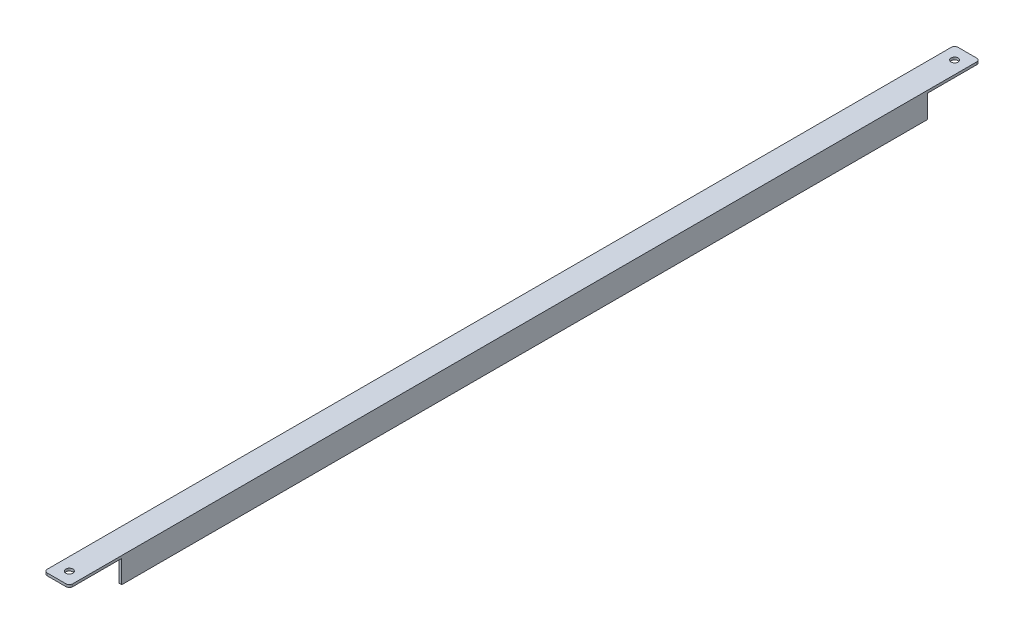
SolidWorks part; units mm, degrees
ref_plane "Front Plane" through (0, 0, 0) normal (0, 0, 1) x (1, 0, 0)
ref_plane "Top Plane" through (0, 0, 0) normal (0, 1, 0) x (1, 0, 0)
ref_plane "Right Plane" through (0, 0, 0) normal (1, 0, 0) x (0, 0, -1)
sketch "Sketch2" plane through (0, 0, 0) normal (0, 0, 1) x (1, 0, 0)
  line L1 (-15, -15) -> (15, -15)
  line L2 (-15, -15) -> (-15, 15)
  line L3 (-15, 15) -> (15, 15)
  line L4 (15, -15) -> (15, 15)
  line L5 (-15, -15) -> (15, 15) construction
  line L6 (-15, 15) -> (15, -15) construction
  point P0 (0, 0)
  dimension "D1" = 30
  dimension "D2" = 30
extrude "Boss-Extrude1" add sketch "Sketch2" along normal mid plane 1078
sketch "Sketch3" plane through (0, 0, 539) normal (0, 0, 1) x (1, 0, 0)
  line L0 (-15, -15) -> (15, -15) construction
  line L1 (12, -15) -> (-12, -15)
  line L2 (12, -15) -> (12, 12)
  line L3 (12, 12) -> (-12, 12)
  line L4 (-12, -15) -> (-12, 12)
  line L5 (-15, 15) -> (-15, -15) construction
  line L6 (15, 15) -> (-15, 15) construction
  line L7 (15, -15) -> (15, 15) construction
  dimension "D1" = 3
  dimension "D2" = 3
  dimension "D3" = 3
extrude "Cut-Extrude1" cut sketch "Sketch3" against normal through all
sketch "Sketch4" plane through (15, 0, 0) normal (1, 0, 0) x (0, 0, -1)
  line L0 (-539, 15) -> (539, 15) construction
  line L1 (539, -15) -> (477, -15)
  line L2 (539, -15) -> (539, 12)
  line L3 (539, 12) -> (477, 12)
  line L4 (477, -15) -> (477, 12)
  dimension "D1" = 3
  dimension "D2" = 62
extrude "Cut-Extrude2" cut sketch "Sketch4" against normal through all
mirror "Mirror1" about plane through (0, 0, 0) normal (0, 0, 1) of "Cut-Extrude2"
sketch "Sketch5" plane through (0, 15, 0) normal (0, 1, 0) x (1, 0, 0)
  line L0 (-15, -539) -> (-15, 539) construction
  line L1 (15, 539) -> (-15, 539) construction
  circle A0 centre (0, 524) radius 4.25
  point P0 (0, 524)
  dimension "D3" = 8.5
  dimension "D1" = 15
  dimension "D2" = 15
extrude "Cut-Extrude3" cut sketch "Sketch5" against normal through all contours A0
mirror "Mirror2" about plane through (0, 0, 0) normal (0, 0, 1) of "Cut-Extrude3"
fillet "Fillet1" radius 4 4 edges at (15, 13.5, 539) (-15, 13.5, 539) (15, 13.5, -539) (-15, 13.5, -539)
